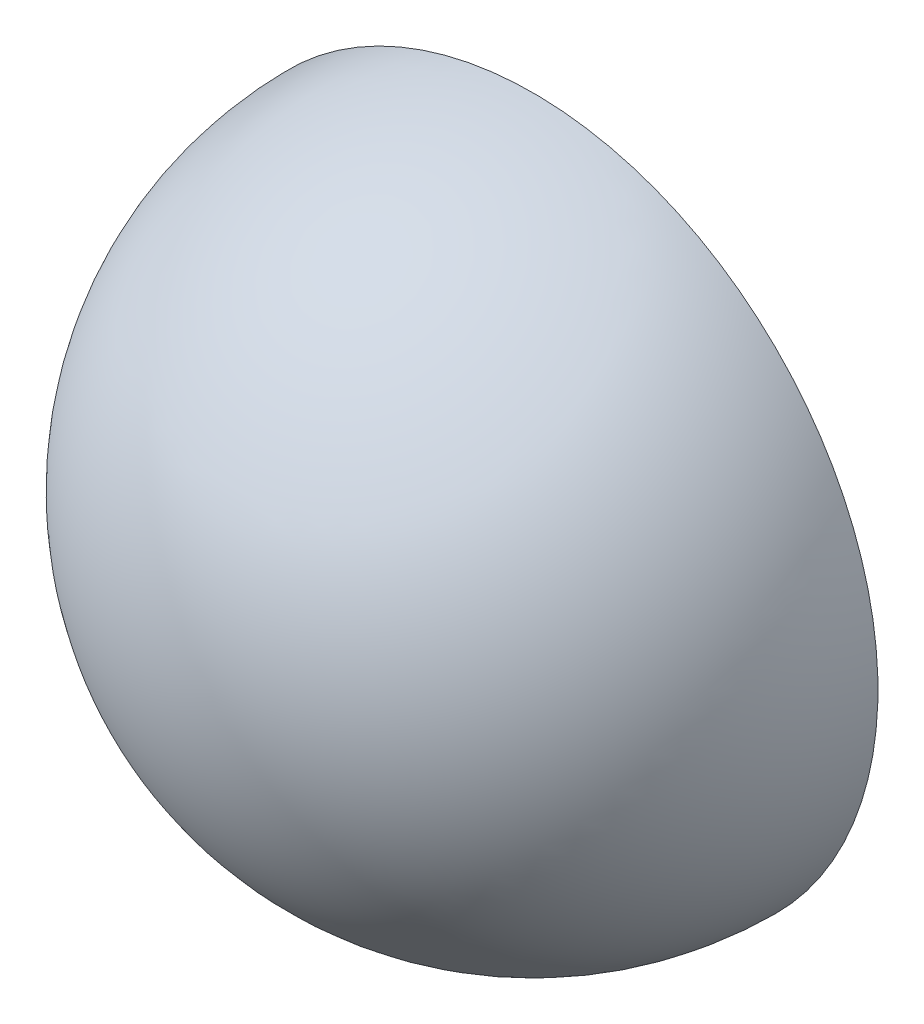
SolidWorks part; units mm, degrees
ref_plane "Front Plane" through (0, 0, 0) normal (0, 0, 1) x (1, 0, 0)
ref_plane "Top Plane" through (0, 0, 0) normal (0, 1, 0) x (1, 0, 0)
ref_plane "Right Plane" through (0, 0, 0) normal (1, 0, 0) x (0, 0, -1)
sketch "Sketch1" plane through (0, 0, 0) normal (0, 0, 1) x (1, 0, 0)
  line L0 (0, 38.1) -> (0, 34.3582)
  line L1 (0, -34.3582) -> (0, -38.1)
  arc A0 (0, -38.1) -> (0, 38.1) centre (0, 0) ccw
  arc A1 (0, -34.3582) -> (0, 34.3582) centre (0, 0) ccw
revolve "Revolve1" add sketch "Sketch1" angle 180 about L0
